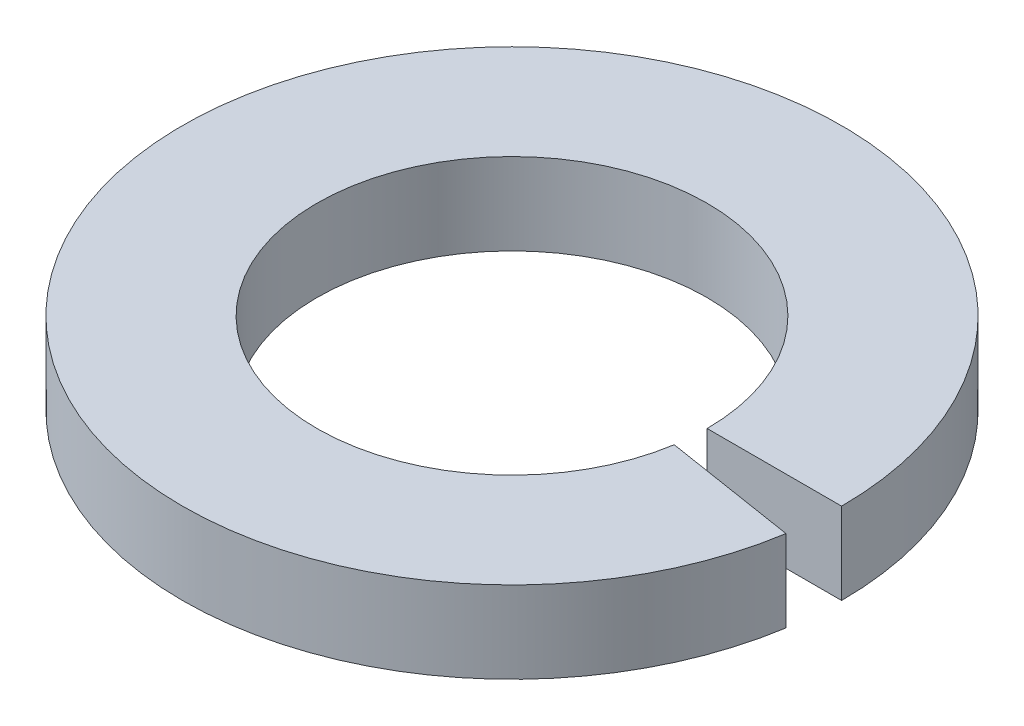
SolidWorks part; units mm, degrees
ref_plane "Front" through (0, 0, 0) normal (0, 0, 1) x (1, 0, 0)
ref_plane "Top" through (0, 0, 0) normal (0, 1, 0) x (1, 0, 0)
ref_plane "Right" through (0, 0, 0) normal (1, 0, 0) x (0, 0, -1)
sketch "Sketch1" plane through (0, 0, 0) normal (0, 0, 1) x (1, 0, 0)
  line L0 (0, -39.37) -> (0, 40.1574) construction
  line L1 (1.8796, 0) -> (1.8796, 0.7874)
  line L2 (1.8796, 0.7874) -> (3.175, 0.7874)
  line L3 (3.175, 0.7874) -> (3.175, 0)
  line L4 (3.175, 0) -> (1.8796, 0)
revolve "Base-Revolve" add sketch "Sketch1" angle 351 about L0
